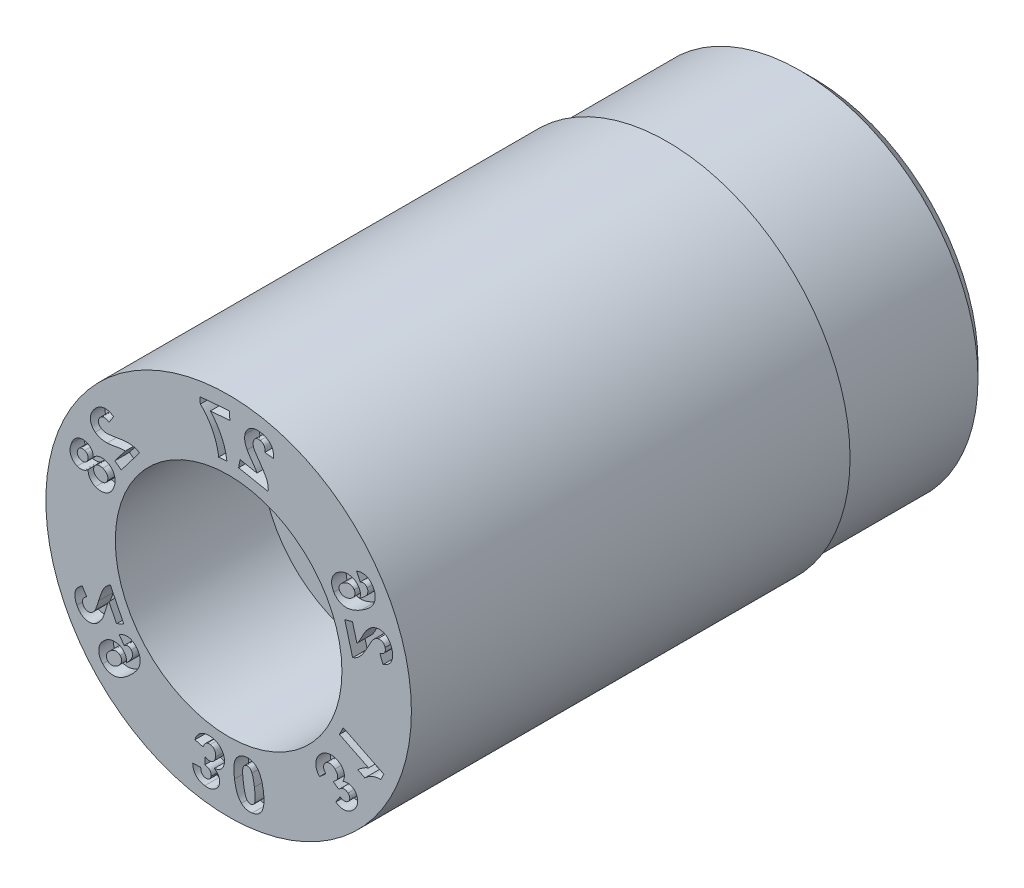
SolidWorks part; units mm, degrees
ref_plane "Front Plane" through (0, 0, 0) normal (0, 0, 1) x (1, 0, 0)
ref_plane "Top Plane" through (0, 0, 0) normal (0, 1, 0) x (1, 0, 0)
ref_plane "Right Plane" through (0, 0, 0) normal (1, 0, 0) x (0, 0, -1)
sketch "Sketch1" plane through (0, 0, 0) normal (1, 0, 0) x (0, 0, -1)
  line L2 (0, 2.5) -> (0, 1.55)
  line L3 (7.75, 2.5) -> (0, 2.5)
  line L4 (-3.7979, 0) -> (49996.2021, 0) construction
  line L8 (8, 0.8) -> (2, 0.8)
  line L9 (2, 1.55) -> (2, 0.8)
  line L10 (2, 1.55) -> (0, 1.55)
  line L12 (8, 0.8) -> (8, 2.25)
  line L16 (8, 2.25) -> (7.75, 2.5)
  dimension "D1" = 8
  dimension "D2" = 45
  dimension "D3" = 0.25
  dimension "D4" = 5
  dimension "D5" = 3.1
  dimension "D6" = 2
  dimension "D7" = 1.6
revolve "Revolve1" add sketch "Sketch1" angle 360 about L4
sketch "Sketch4" plane through (0, 0, 0) normal (1, 0, 0) x (0, 0, -1)
  line L0 (0, 0) -> (50000, 0) construction
  line L1 (8, -2.25) -> (8, 2.25) construction
  line L2 (6, 3.435) -> (8, 3.435)
  line L3 (6, 3.435) -> (6, 2.435)
  line L4 (6, 2.435) -> (8, 2.435)
  line L5 (8, 3.435) -> (8, 2.435)
  line L6 (7.75, 2.5) -> (0, 2.5) construction
  line L7 (0, 2.5) -> (0, -2.5) construction
  dimension "D1" = 1
  dimension "D2" = 0.065
  dimension "D3" = 6
revolve "Cut-Revolve1" cut sketch "Sketch4" angle 360 about L0
sketch "Sketch6" plane through (0, 0, 0) normal (0, 0, 1) x (1, 0, 0)
  arc A0 (1.7016, 0.2135) -> (1.7127, -0.0874) centre (0, 0) ccw construction
  text T0 "26    27    28    29   30   31" font "Arial" height 0.62
  dimension "D1" = 1.715
extrude "Cut-Extrude1" cut sketch "Sketch6" against normal blind 0.2
